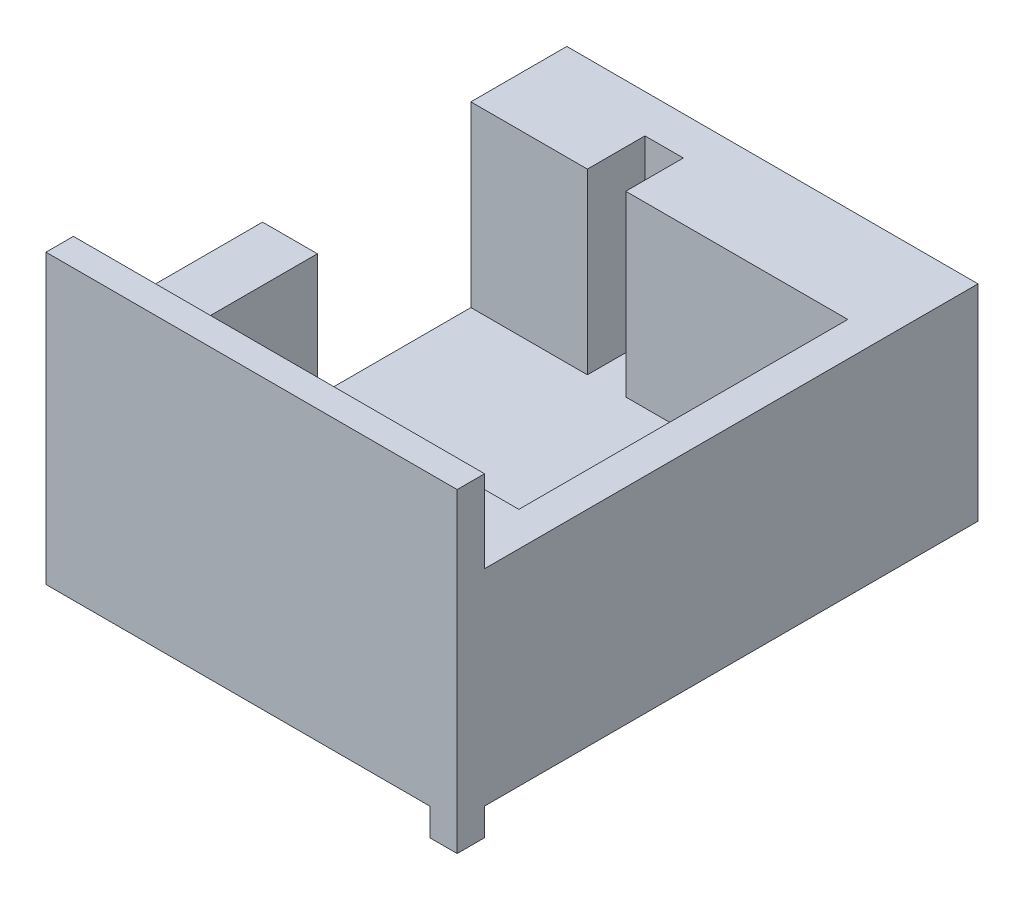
SolidWorks part; units mm, degrees
ref_plane "前视基准面" through (0, 0, 0) normal (0, 0, 1) x (1, 0, 0)
ref_plane "上视基准面" through (0, 0, 0) normal (0, 1, 0) x (1, 0, 0)
ref_plane "右视基准面" through (0, 0, 0) normal (1, 0, 0) x (0, 0, -1)
sketch "草图1" plane through (0, 0, 0) normal (0, 1, 0) x (1, 0, 0)
  line L1 (-15, -19) -> (15, -19)
  line L2 (-15, -19) -> (-15, 19)
  line L3 (-15, 19) -> (15, 19)
  line L4 (15, -19) -> (15, 19)
  line L5 (-15, -19) -> (15, 19) construction
  line L6 (-15, 19) -> (15, -19) construction
  point P0 (0, 0)
  dimension "D1" = 30
  dimension "D2" = 38
extrude "凸台-拉伸1" add sketch "草图1" along normal blind 15
sketch "草图4" plane through (0, 15, 0) normal (0, 1, 0) x (1, 0, 0)
  line L0 (-18.185, 0) -> (17.1592, 0) construction
  line L1 (12.5, 12) -> (12.5, -12)
  line L2 (12.5, -12) -> (-3.7, -12)
  line L3 (-3.7, -12) -> (-3.7, -16.2)
  line L4 (-3.7, -16.2) -> (-6.5, -16.2)
  line L5 (-6.5, -16.2) -> (-6.5, -12)
  line L6 (-6.5, -12) -> (-11, -12)
  line L7 (-15, 19) -> (-15, -19) construction
  line L8 (-11, -12) -> (-11, 12)
  line L9 (15, -19) -> (15, 19) construction
  line L10 (-6.5, 12) -> (-11, 12)
  line L11 (-6.5, 16.2) -> (-6.5, 12)
  line L12 (-3.7, 16.2) -> (-6.5, 16.2)
  line L13 (-3.7, 12) -> (-3.7, 16.2)
  line L14 (12.5, 12) -> (-3.7, 12)
  point P16 (-11, 0)
  point P21 (12.5, 0)
  dimension "D1" = 2.5
  dimension "D2" = 11.3
  dimension "D3" = 2.8
  dimension "D4" = 24
  dimension "D5" = 16.2
  dimension "D6" = 24
  dimension "D7" = 4
extrude "切除-拉伸3" cut sketch "草图4" against normal blind 13
sketch "草图6" plane through (-15, 0, 0) normal (-1, 0, 0) x (0, 0, 1)
  line L0 (0, 14.3) -> (0, 2) construction
  line L1 (-19, 0) -> (19, 0) construction
  line L2 (0, 8.15) -> (19.5542, 8.15) construction
  line L3 (12, 2) -> (12, 15) construction
  line L4 (12, 2) -> (12, 15) construction
  line L5 (12, 8.15) -> (12, 15)
  line L6 (12, 15) -> (-2.1962, 15)
  line L7 (-19, 15) -> (19, 15) construction
  line L8 (-2.1962, 15) -> (-2.1962, 8.15)
  line L9 (2.1962, 15) -> (2.1962, 8.15)
  line L10 (-12, 15) -> (2.1962, 15)
  line L11 (-12, 8.15) -> (-12, 15)
  circle A0 centre (6, 8.15) radius 6
  circle A1 centre (0.8038, 8.15) radius 3
  circle A2 centre (-0.8038, 8.15) radius 3
  circle A3 centre (-6, 8.15) radius 6
  point P13 (0.8038, 5.15)
  point P23 (-0.8038, 5.15)
  dimension "D3" = 12
  dimension "D4" = 6
  dimension "D1" = 2
  dimension "D2" = 12.3
extrude "切除-拉伸5" cut sketch "草图6" against normal up to next contours A3 A2 L8 | L11 A3 L8 M3 | A3 A1 L8 A2 | A3 A2 L8 A1 | A3 A1 | A1 A3 A0 A2 | A2 A0 | A3 L8 A2 | L8 A3 A2 A1 A0 L9 L6 | A0 A2 L9 A1 | A1 L9 A0 | A1 A2 A0 | A2 A3 A1
sketch "草图7" plane through (0, 0, 0) normal (0, -1, 0) x (1, 0, 0)
  line L1 (15, 19) -> (13, 19)
  line L2 (15, 19) -> (15, 17)
  line L3 (15, 17) -> (13, 17)
  line L4 (13, 19) -> (13, 17)
  dimension "D1" = 2
  dimension "D2" = 2
extrude "凸台-拉伸2" add sketch "草图7" along normal blind 2
sketch "草图8" plane through (15, 0, 0) normal (1, 0, 0) x (0, 0, -1)
  line L1 (-19, 15) -> (-17, 15)
  line L2 (-19, 15) -> (-19, 21)
  line L3 (-19, 21) -> (-17, 21)
  line L4 (-17, 15) -> (-17, 21)
  dimension "D1" = 2
  dimension "D2" = 6
extrude "凸台-拉伸3" add sketch "草图8" against normal up to surface (30 mm away)
sketch "草图9" plane through (0, 2, 0) normal (0, 1, 0) x (1, 0, 0)
  line L0 (-3.7, -12) -> (12.5, -12) construction
  line L1 (12.5, 12) -> (9.5, 12)
  line L2 (12.5, 12) -> (12.5, -12)
  line L3 (12.5, -12) -> (9.5, -12)
  line L4 (9.5, 12) -> (9.5, -12)
  dimension "D1" = 3
extrude "切除-拉伸6" cut sketch "草图9" against normal blind 10
sketch "草图10" plane through (-15, 0, 0) normal (-1, 0, 0) x (0, 0, 1)
  line L2 (-12, 15) -> (3.2, 15)
  line L3 (-12, 15) -> (-12, 2)
  line L4 (-12, 2) -> (3.2, 2)
  line L5 (3.2, 15) -> (3.2, 2)
  dimension "D1" = 15.2
  dimension "D2" = 13
extrude "切除-拉伸7" cut sketch "草图10" against normal up to next
